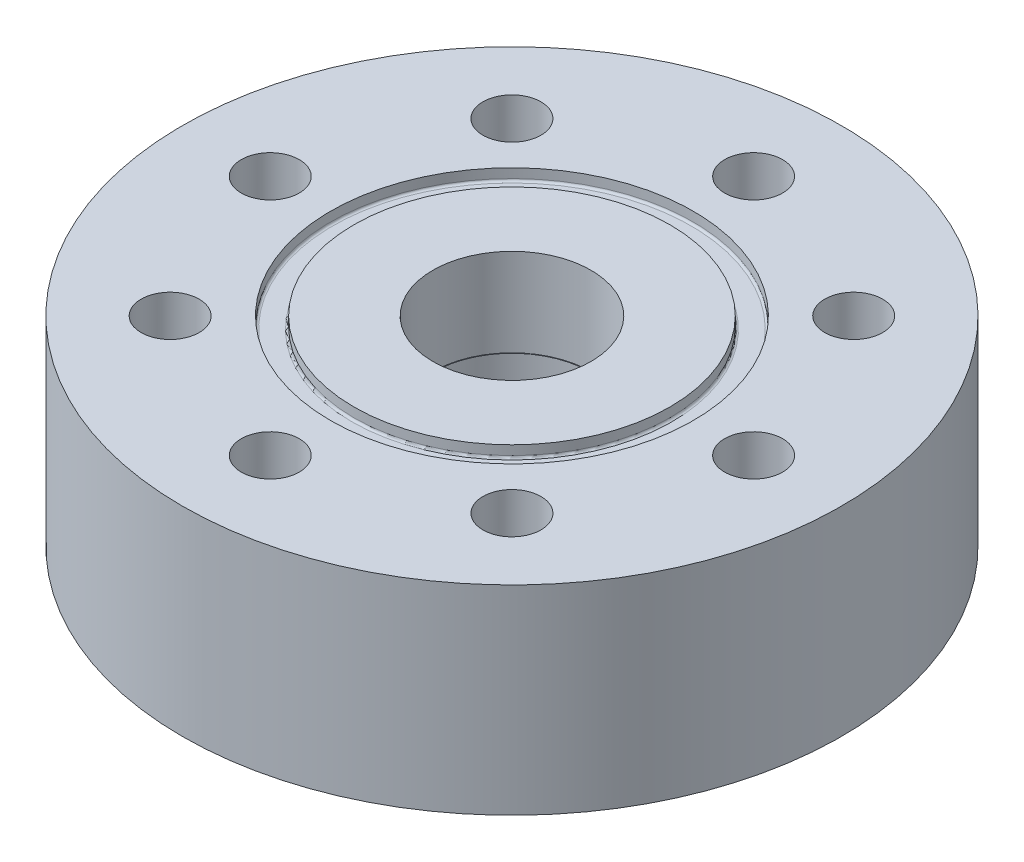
SolidWorks part; units mm, degrees
ref_plane "Front Plane" through (0, 0, 0) normal (0, 0, 1) x (1, 0, 0)
ref_plane "Top Plane" through (0, 0, 0) normal (0, 1, 0) x (1, 0, 0)
ref_plane "Right Plane" through (0, 0, 0) normal (1, 0, 0) x (0, 0, -1)
sketch "Sketch2" plane through (0, 0, 0) normal (0, 1, 0) x (1, 0, 0)
  circle A0 centre (0, 0) radius 37.5
  dimension "D1" = 75
extrude "Outer Cylinder" add sketch "Sketch2" along normal blind 22.7
sketch "Sketch3" plane through (0, 0, 0) normal (0, -1, 0) x (1, 0, 0)
  circle A0 centre (0, 0) radius 8.93
  dimension "D1" = 17.86
extrude "NPT Hole" cut sketch "Sketch3" against normal blind 12.7
sketch "Sketch4" plane through (0, 0, 0) normal (0, -1, 0) x (1, 0, 0)
  circle A0 centre (-27.5, 0) radius 3.3
  circle A1 centre (-19.4454, 19.4454) radius 3.3
  circle A2 centre (0, 27.5) radius 3.3
  circle A3 centre (19.4454, 19.4454) radius 3.3
  circle A4 centre (27.5, 0) radius 3.3
  circle A5 centre (19.4454, -19.4454) radius 3.3
  circle A6 centre (0, -27.5) radius 3.3
  circle A7 centre (-19.4454, -19.4454) radius 3.3
  point P19 (0, 0)
  dimension "D1" = 6.6
  dimension "D2" = 27.5
  dimension "D3" = 8
extrude "Bolt Holes" cut sketch "Sketch4" against normal through all
sketch "Sketch5" plane through (0, 22.7, 0) normal (0, 1, 0) x (1, 0, 0)
  circle A0 centre (0, 0) radius 17.9705
  circle A1 centre (0, 0) radius 20.6375
  dimension "D1" = 41.275
  dimension "D2" = 2.667
extrude "O-Ring Groove" cut sketch "Sketch5" against normal blind 1.3208
fillet "Fillet1" radius 0.254 2 edges at (0, 21.3792, 17.9705) (0, 21.3792, 20.6375)
sketch "Sketch6" plane through (0, 22.7, 0) normal (0, 1, 0) x (1, 0, 0)
  circle A0 centre (0, 0) radius 9
extrude "Inlet Flow Diameter" cut sketch "Sketch6" against normal blind 10
equation "\"D\"= 18"
equation "\"Inlet Flow Diameter\"= \"D\""
equation "\"D1@Sketch6\"=\"D\""
